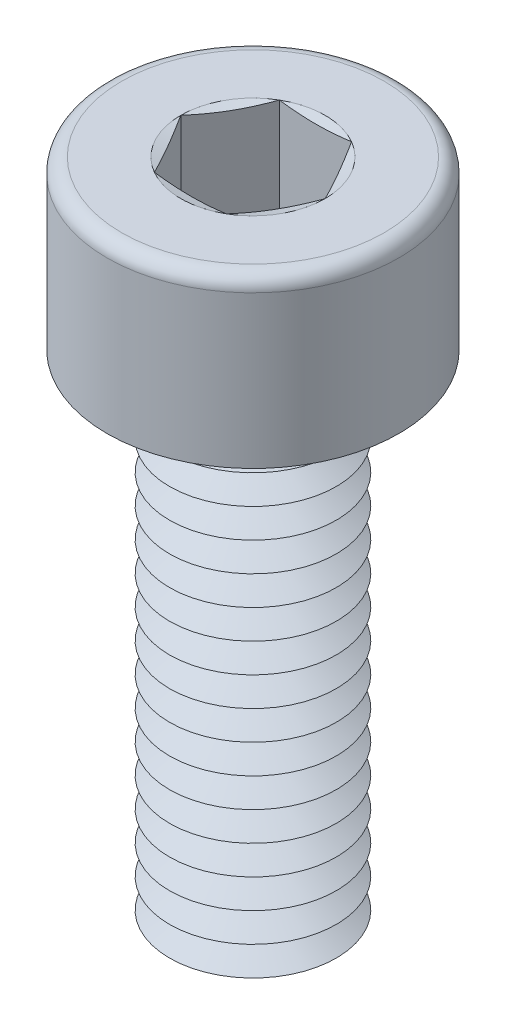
SolidWorks part; units mm, degrees
ref_plane "Front Plane" through (0, 0, 0) normal (0, 0, 1) x (1, 0, 0)
ref_plane "Top Plane" through (0, 0, 0) normal (0, 1, 0) x (1, 0, 0)
ref_plane "Right Plane" through (0, 0, 0) normal (1, 0, 0) x (0, 0, -1)
sketch "Sketch1" plane through (0, 0, 0) normal (0, 1, 0) x (1, 0, 0)
  circle A0 centre (0, 0) radius 2
  dimension "D1" = 4
extrude "Extrude1" add sketch "Sketch1" along normal blind 12
sketch "Sketch2" plane through (0, 12, 0) normal (0, 1, 0) x (1, 0, 0)
  circle A0 centre (0, 0) radius 3.5
  dimension "D1" = 7
extrude "Extrude2" add sketch "Sketch2" along normal blind 4
sketch "Sketch3" plane through (0, 16, 0) normal (0, 1, 0) x (1, 0, 0)
  line L1 (0.866, 1.5) -> (-0.866, 1.5)
  line L2 (-0.866, 1.5) -> (-1.7321, 0)
  line L3 (-1.7321, 0) -> (-0.866, -1.5)
  line L4 (-0.866, -1.5) -> (0.866, -1.5)
  line L5 (0.866, -1.5) -> (1.7321, 0)
  line L6 (1.7321, 0) -> (0.866, 1.5)
  circle A0 centre (0, 0) radius 1.5 construction
  dimension "D1" = 3
extrude "Extrude3" cut sketch "Sketch3" against normal blind 3
fillet "Fillet1" radius 0.35 1 edges at (0, 16, 3.5)
sketch "Sketch4" plane through (0, 0, 0) normal (1, 0, 0) x (0, 0, -1)
  line L0 (-1.5, 13) -> (0, 13)
  line L1 (0, 13) -> (0, 12.134)
  line L2 (0, 12.134) -> (-1.5, 13)
  dimension "D1" = 30
revolve "Cut-Revolve1" cut sketch "Sketch4" angle 360 about L1
sketch "Sketch5" plane through (0, 0, 0) normal (0, 0, 1) x (1, 0, 0)
  line L0 (-2, 0.35) -> (-2, -0.35)
  line L1 (-2, 12) -> (-2, 0) construction
  line L2 (-2, -0.35) -> (-1.3938, 0)
  line L3 (-2, 0) -> (2, 0) construction
  line L4 (-1.3938, 0) -> (-2, 0.35)
  dimension "D1" = 0.7
revolve "Cut-Revolve2" cut sketch "Sketch5" angle 360 about axis through (0, 12, 0) along (0, -1, 0)
pattern_linear "LPattern1" count 17 spacing 0.7 along (0, 1, 0) of "Cut-Revolve2"
sketch "Sketch6" plane through (0, 16, 0) normal (0, 1, 0) x (1, 0, 0)
  circle A0 centre (0, 0) radius 1.7321
extrude "Extrude4" cut sketch "Sketch6" against normal through all draft 75
